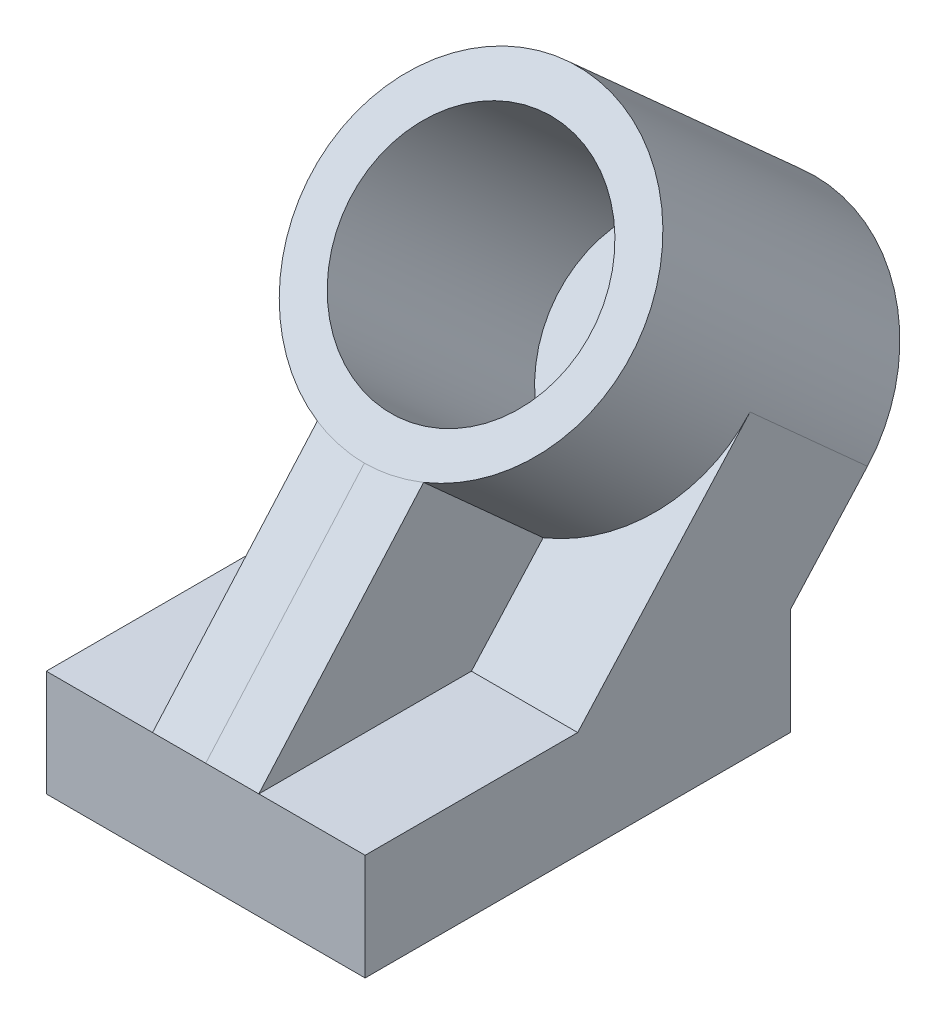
SolidWorks part; units mm, degrees
ref_plane "Front Plane" through (0, 0, 0) normal (0, 0, 1) x (1, 0, 0)
ref_plane "Top Plane" through (0, 0, 0) normal (0, 1, 0) x (1, 0, 0)
ref_plane "Right Plane" through (0, 0, 0) normal (1, 0, 0) x (0, 0, -1)
sketch "Sketch1" plane through (0, 0, 0) normal (1, 0, 0) x (0, 0, -1)
  line L0 (0, 0) -> (50.8, 0)
  line L1 (0, 0) -> (0, -25.4)
  line L2 (0, -25.4) -> (101.6, -25.4)
  line L3 (101.6, -25.4) -> (101.6, 0)
  line L4 (101.6, 0) -> (120.0427, 20.4827)
  line L5 (101.6, 0) -> (131.3247, 0) construction
  line L6 (50.8, 0) -> (91.9877, 45.7436)
  line L8 (120.0427, 20.4827) -> (91.9877, 45.7436)
  dimension "D1" = 50.8
  dimension "D2" = 25.4
  dimension "D3" = 101.6
  dimension "D4" = 48
extrude "Boss-Extrude1" add sketch "Sketch1" against normal blind 76.2
sketch "Sketch2" plane through (0, -25.2609, -28.055) normal (0, 0.6691, 0.7431) x (1, 0, 0)
  line L0 (-38.1, -18.8759) -> (-38.1, 95.4241) construction
  line L1 (-76.2, -18.8759) -> (0, -18.8759) construction
  dimension "D1" = 114.3
sketch "Sketch3" plane through (0, -25.2609, -28.055) normal (0, 0.6691, 0.7431) x (1, 0, 0)
  line L0 (-76.2, 95.5459) -> (0, 95.5459)
  arc A0 (-76.2, 95.5459) -> (0, 95.5459) centre (-38.1, 95.5459) ccw
extrude "Cut-Extrude2" cut sketch "Sketch3" against normal up to surface (37.7518 mm away)
sketch "Sketch5" plane through (0, -50.5217, -56.11) normal (0, -0.6691, -0.7431) x (-1, 0, 0)
  line L0 (38.1, 95.5459) -> (0, 95.5459) construction
  arc A0 (0, 95.5459) -> (76.2, 95.5459) centre (38.1, 95.5459) ccw construction
  circle A1 centre (38.1, 95.5459) radius 38.1
  circle A2 centre (38.1, 95.5459) radius 28.575
  dimension "D1" = 9.525
extrude "Boss-Extrude2" add sketch "Sketch5" against normal blind 76.2
sketch "Sketch6" plane through (0, -50.5217, -56.11) normal (0, -0.6691, -0.7431) x (-1, 0, 0)
  arc A0 (45.6403, 67.9837) -> (30.5597, 67.9837) centre (38.1, 95.5459) ccw construction
  circle A1 centre (38.1, 95.5459) radius 28.575
extrude "Boss-Extrude4" add sketch "Sketch6" against normal blind 9.525
ref_plane "Plane1" through (-38.1, 0, 0) normal (1, 0, 0) x (0, 0, -1)
sketch "Sketch9" plane through (-38.1, 0, 0) normal (1, 0, 0) x (0, 0, -1)
  line L0 (50.8, 0) -> (0, 0)
  line L1 (50.8, 0) -> (0, 0)
  line L2 (66.4938, 17.4297) -> (50.8, 0)
  line L3 (66.4938, 17.4297) -> (50.8, 0)
  line L4 (37.9212, 43.1566) -> (66.4938, 17.4297)
  line L5 (145.5366, 48.7965) -> (88.9089, 99.7843)
  line L7 (37.9212, 43.1566) -> (66.4938, 17.4297)
  line L8 (0, 0) -> (37.9212, 43.1566)
ref_plane "Plane2" through (-25.4, 0, 0) normal (1, 0, 0) x (0, 0, -1)
sketch "Sketch11" plane through (-25.4, 0, 0) normal (1, 0, 0) x (0, 0, -1)
  line L0 (50.8, 0) -> (0, 0)
  line L1 (50.8, 0) -> (0, 0)
  line L2 (67.9518, 19.049) -> (50.8, 0)
  line L3 (67.9518, 19.049) -> (50.8, 0)
  line L4 (39.3792, 44.7759) -> (67.9518, 19.049)
  line L5 (144.0786, 47.1772) -> (87.4509, 98.165)
  line L6 (0, 0) -> (39.3792, 44.7759)
  line L7 (39.3792, 44.7759) -> (67.9518, 19.049)
sketch "Sketch12" plane through (0, 0.466, 0.5176) normal (0, 0.6691, 0.7431) x (1, 0, 0)
  circle A0 centre (-38.1, 95.5459) radius 38.1 construction
  circle A1 centre (-38.1, 95.5459) radius 38.1
sketch "Sketch13" plane through (0, 0, 0) normal (0, 1, 0) x (1, 0, 0)
  line L0 (-38.1, 0) -> (-25.4, 0)
loft "Loft2" add profiles "Sketch9", "Sketch11"
mirror "Mirror1" about plane through (-38.1, 0, 0) normal (1, 0, 0) of "Loft2"
